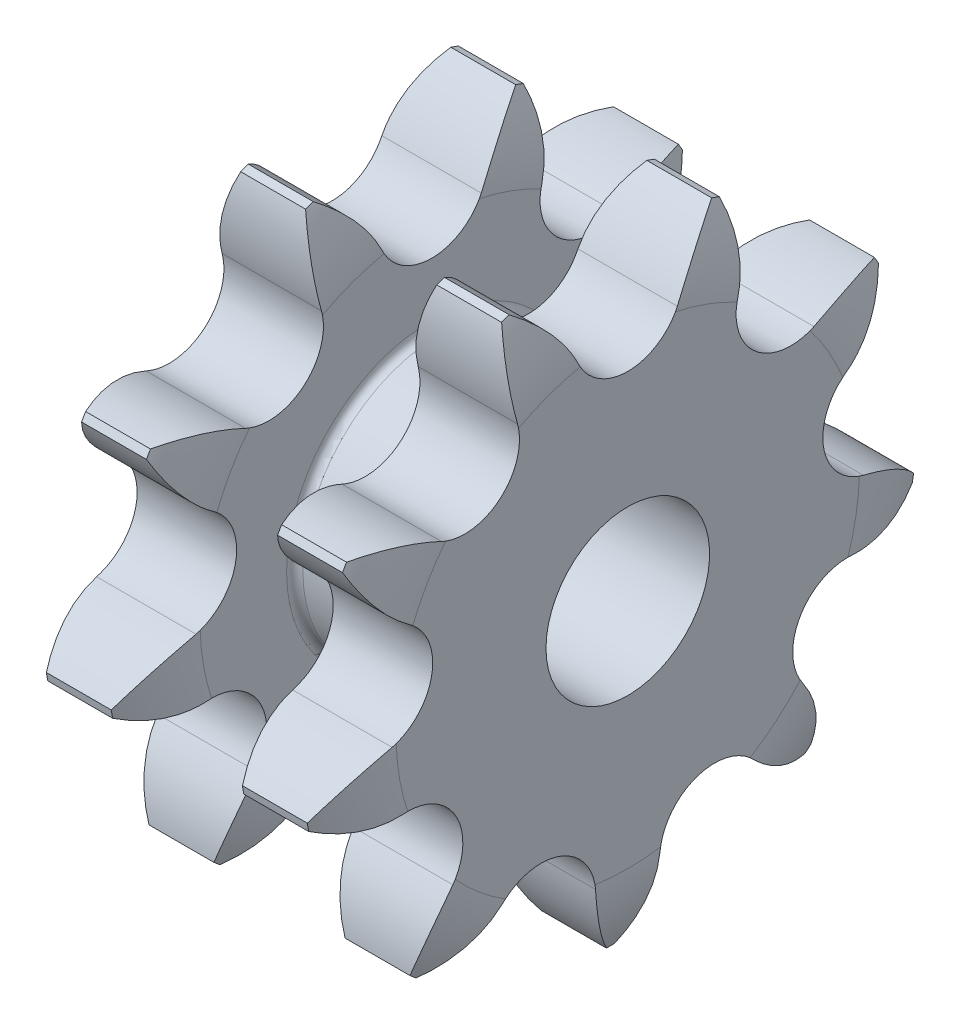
SolidWorks part; units mm, degrees
ref_plane "Plane1" through (0, 0, 0) normal (0, 0, 1) x (1, 0, 0)
ref_plane "Plane2" through (0, 0, 0) normal (0, 1, 0) x (1, 0, 0)
ref_plane "Plane3" through (0, 0, 0) normal (1, 0, 0) x (0, 0, -1)
sketch "Clipboard" plane through (0, 0, 0) normal (0, 1, 0) x (1, 0, 0)
  line L0 (0, 0) -> (12.5436, -1.9867)
  line L1 (-15, 0) -> (100, 0) construction
  line L2 (0, 0) -> (-0.8416, 0.9512)
  line L3 (0, 0) -> (-11.863, 4.5341)
  line L4 (0, 0) -> (3.0618, 0.4849)
  line L5 (0, 0) -> (-2.8109, -1.0484)
  line L6 (0, 0) -> (-17.9719, -12.1257)
  line L7 (-0.8416, 0.9512) -> (22.6002, 5.5078)
  line L8 (-76.2, 38.1) -> (-75.2, 38.1)
  line L9 (-73.4321, 41.7084) -> (-72.837, 41.7846)
  line L10 (-73.4741, 12.9512) -> (-59.0941, 12.9512)
  circle A0 centre (0, 0) radius 3.975
  circle A1 centre (0, 0) radius 10.0465
  circle A2 centre (0, 0) radius 25
sketch "BasProSke" plane through (0, 0, 0) normal (0, 1, 0) x (1, 0, 0)
  line L0 (-10, 0) -> (60, 0) construction
  line L1 (0, 0) -> (0, 16.9929)
  line L2 (0, 0) -> (21.68, 0)
  line L3 (21.68, 0) -> (21.68, 16.9929)
  line L4 (20.41, 22.5287) -> (1.27, 22.5287)
  arc A0 (0, 16.9929) -> (1.27, 22.5287) centre (12.7, 16.9929) cw
  arc A1 (21.68, 16.9929) -> (20.41, 22.5287) centre (8.98, 16.9929) ccw
revolve "Base-Revolve" add sketch "BasProSke" angle 360 about L0
sketch "GrvSke" plane through (0, 0, 0) normal (0, 1, 0) x (1, 0, 0)
  line L0 (7.3, 16.9929) -> (7.3, 10.6465)
  line L1 (7.9, 10.0465) -> (13.78, 10.0465)
  line L2 (14.38, 10.6465) -> (14.38, 16.9929)
  line L3 (6.03, 22.5287) -> (15.65, 22.5287)
  line L4 (10.84, 0) -> (10.84, 52.07) construction
  line L5 (-10, 0) -> (60, 0) construction
  line L6 (0, 0) -> (35.56, 0) construction
  arc A0 (14.38, 16.9929) -> (15.65, 22.5287) centre (27.08, 16.9929) cw
  arc A1 (7.3, 16.9929) -> (6.03, 22.5287) centre (-5.4, 16.9929) ccw
  arc A2 (7.3, 10.6465) -> (7.9, 10.0465) centre (7.9, 10.6465) ccw
  arc A3 (13.78, 10.0465) -> (14.38, 10.6465) centre (13.78, 10.6465) ccw
revolve "Groove" cut sketch "GrvSke" angle 360 about L6
sketch "TooCutSke" plane through (0, 0, 0) normal (1, 0, 0) x (0, 0, -1)
  line L0 (0, 18.6059) -> (3.6386, 16.9092) construction
  line L1 (0, 0) -> (0, 107) construction
  line L2 (0, 18.6059) -> (-10, 18.6059) construction
  line L3 (0, 18.6059) -> (-3.6386, 16.9092) construction
  arc A0 (3.6386, 16.9092) -> (7.9748, 21.6037) centre (13.1494, 12.4742) cw
  arc A1 (3.6386, 16.9092) -> (-3.6386, 16.9092) centre (0, 18.6059) cw
  arc A2 (-3.6386, 16.9092) -> (-7.9748, 21.6037) centre (-13.1494, 12.4742) ccw
  arc A3 (7.9748, 21.6037) -> (-7.9748, 21.6037) centre (0, 0) ccw
extrude "ToothCut" cut sketch "TooCutSke" along normal through all
pattern_circular "TeethCuts" count 9 every 40 about axis through (-10, 0, 0) along (1, 0, 0) of "ToothCut"
sketch "HubNeaOneSke" plane through (0, 0, 0) normal (-1, 0, 0) x (0, 0, 1)
  circle A0 centre (0, 0) radius 10.0465
extrude "HubNearOne" [suppressed] add sketch "HubNeaOneSke" along normal blind 2.2005
fillet "HubNearOneFillet" [suppressed] radius 0.6
sketch "HubNeaBotSke" plane through (0, 0, 0) normal (-1, 0, 0) x (0, 0, 1)
  circle A0 centre (0, 0) radius 10.0465
extrude "HubNearBoth" [suppressed] add sketch "HubNeaBotSke" along normal blind 1.1003
fillet "HubNearBothFillet" [suppressed] radius 0.6
ref_plane "FarPln" through (21.68, 0, 0) normal (1, 0, 0) x (0, 0, -1)
sketch "HubFarSke" plane through (21.68, 0, 0) normal (1, 0, 0) x (0, 0, -1)
  circle A0 centre (0, 0) radius 10.0465
extrude "HubFar" [suppressed] add sketch "HubFarSke" along normal blind 1.1003
fillet "HubFarFillet" [suppressed] radius 0.6
sketch "BorSke" plane through (0, 0, 0) normal (1, 0, 0) x (0, 0, -1)
  circle A0 centre (0, 0) radius 6
extrude "Bore" cut sketch "BorSke" along normal mid plane 47.761
sketch "KeySke" plane through (0, 0, 0) normal (1, 0, 0) x (0, 0, -1)
  line L0 (-1, 0) -> (-1, 7)
  line L1 (-1, 7) -> (1, 7)
  line L2 (1, 7) -> (1, 0)
  line L3 (0, 0) -> (0, 34) construction
  line L4 (-1, 0) -> (1, 0)
extrude "Keyway" [suppressed] cut sketch "KeySke" along normal mid plane 47.761
pattern_circular "Keyway2" [suppressed] count 2 every 90 about axis through (-10, 0, 0) along (1, 0, 0)
equation "' \"Pitch@Clipboard\" = 12.7"
equation "' \"Num_strands@Clipboard\" = 2"
equation "' \"Num_teeth@Clipboard\" = 9"
equation "' \"Hub_dia@Clipboard\" = 50"
equation "' \"Overall_len@Clipboard\" = 3"
equation "' \"Diameter@BorSke\" = 12"
equation "' \"T_dim@Clipboard\" = 1"
equation "' \"Width@KeySke\" = 2"
equation "' \"Dr@Clipboard\" = 7.95"
equation "' \"Face_width@Clipboard\" = 7.3"
equation "' \"Side_radius@Clipboard\" = 12.7"
equation "' \"Side_relief@Clipboard\" = 1.27"
equation "' \"Transv_pitch@Clipboard\" = 14.38"
equation "' \"Show_teeth@Clipboard\" = 9"
equation "' \"Fillet_rad@Clipboard\" = 0.6"
equation "' \"Plate_wid@Clipboard\" = 12"
equation "\"Num_teeth@Clipboard\" = int( \"Num_teeth@Clipboard\" )"
equation "\"Num_teeth@Clipboard\" = ((sgn( \"Num_teeth@Clipboard\" - 5.0)+1)*( \"Num_teeth@Clipboard\" - 5.0))/2 +5.0"
equation "\"Num_teeth@Clipboard\" = ((sgn( \"Num_teeth@Clipboard\" - 200.0)-1)*( \"Num_teeth@Clipboard\" - 200.0))/-2 +200.0"
equation "\"MHD@Clipboard\" = \"Pitch@Clipboard\" * (1.0 / tan(3.14159265 / \"Num_teeth@Clipboard\" )) - 1.05 * \"Plate_wid@Clipboard\" - 2.0 * \"Fillet_rad@Clipboard\" - 1.0"
equation "\"Thickness@Clipboard\"  = \"Face_width@Clipboard\" + (\"Num_strands@Clipboard\" - 1) * \"Transv_pitch@Clipboard\""
equation "\"OAL@Clipboard\" = \"Thickness@Clipboard\" + 2 * \"Fillet_rad@Clipboard\" + 1"
equation "\"MHD@Clipboard\" = ((sgn( \"MHD@Clipboard\" - \"Hub_dia@Clipboard\" )-1)*( \"MHD@Clipboard\" - \"Hub_dia@Clipboard\" ))/-2+ \"Hub_dia@Clipboard\""
equation "\"OAL@Clipboard\" = ((sgn( \"OAL@Clipboard\" - \"Overall_len@Clipboard\" )+1)*( \"OAL@Clipboard\" - \"Overall_len@Clipboard\" ))/2 + \"Overall_len@Clipboard\" + 0.0005"
equation "\"Num_teeth@TeethCuts\" = int( \"Show_teeth@Clipboard\" ) + 1"
equation "\"Num_teeth@TeethCuts\" = ((sgn( \"Num_teeth@TeethCuts\" - \"Num_teeth@Clipboard\" )-1)*( \"Num_teeth@TeethCuts\" - \"Num_teeth@Clipboard\" ))/-2+ \"Num_teeth@Clipboard\""
equation "\"Num_teeth@TeethCuts\" = ((sgn( \"Num_teeth@TeethCuts\" - 2.0)+1)*( \"Num_teeth@TeethCuts\" - 2.0))/2 +2.0"
equation "\"Angle@TeethCuts\" = 360.0 / \"Num_teeth@Clipboard\""
equation "\"Seat_radius@TooCutSke\" = ( \"Pitch@Clipboard\" / 2.0) / sin(3.14159265 / \"Num_teeth@Clipboard\" ) - \"Dr@Clipboard\" / 2.0 + \"Dr@Clipboard\" * 0.505"
equation "\"R1@TooCutSke\"  = \"Dr@Clipboard\" * 0.505"
equation "\"X@TooCutSke\" = 140.0 - (90.0 / \"Num_teeth@Clipboard\")"
equation "\"R2@TooCutSke\" = 0.12 * \"Dr@Clipboard\" * ( \"Num_teeth@Clipboard\" + 2.0)"
equation "\"Overcut@TooCutSke\" = 0.5 + 0.625 * \"Pitch@Clipboard\" - 0.5 * \"Dr@Clipboard\"  +  \"Pitch@Clipboard\" / 2.0 / sin(3.14159265 / \"Num_teeth@Clipboard\" )"
equation "\"Diameter@BasProSke\" = 2.0 * ( 0.625 * \"Pitch@Clipboard\" - 0.5 * \"Dr@Clipboard\"  +  \"Pitch@Clipboard\" / 2.0 / sin(3.14159265 / \"Num_teeth@Clipboard\" ))"
equation "\"Thickness@BasProSke\"  = \"Thickness@Clipboard\""
equation "\"G1@BasProSke\" =  \"Side_relief@Clipboard\""
equation "\"G2@BasProSke\" =  \"Side_relief@Clipboard\""
equation "\"D1@BasProSke\" =  \"Side_radius@Clipboard\""
equation "\"Diameter@GrvSke\" = \"Diameter@BasProSke\""
equation "\"G1@GrvSke\" = \"Side_relief@Clipboard\""
equation "\"D1@GrvSke\" = \"Side_radius@Clipboard\""
equation "\"Grv_diam@GrvSke\" =  \"Pitch@Clipboard\" * (1.0 / tan(3.14159265 / \"Num_teeth@Clipboard\" ))- 1.05 * \"Plate_wid@Clipboard\" - 2.0 * \"Fillet_rad@Clipboard\" - 1.0"
equation "\"Grv_width@GrvSke\" =  \"Transv_pitch@Clipboard\" - \"Face_width@Clipboard\""
equation "\"Offset@GrvSke\" = \"Grv_width@GrvSke\" / 2.0 + \"Face_width@Clipboard\""
equation "\"Fillet_rad@GrvSke\" = \"Fillet_rad@Clipboard\""
equation "\"Diameter@HubNeaOneSke\" = \"MHD@Clipboard\""
equation "\"Length@HubNearOne\" = \"OAL@Clipboard\" - \"Thickness@BasProSke\""
equation "\"Diameter@HubNeaBotSke\" = \"MHD@Clipboard\""
equation "\"Length@HubNearBoth\" = ( \"OAL@Clipboard\" - \"Thickness@BasProSke\" ) / 2.0"
equation "\"D1@HubNearOneFillet\" = \"Fillet_rad@Clipboard\""
equation "\"D1@HubNearBothFillet\" = \"Fillet_rad@Clipboard\""
equation "\"Thickness@FarPln\" = \"Thickness@BasProSke\""
equation "\"Diameter@HubFarSke\" = \"MHD@Clipboard\""
equation "\"Length@HubFar\" = ( \"OAL@Clipboard\" - \"Thickness@BasProSke\" ) / 2.0"
equation "\"D1@HubFarFillet\" = \"Fillet_rad@Clipboard\""
equation "\"D1@Bore\" = \"OAL@Clipboard\" * 2.0"
equation "\"D1@Keyway\" = \"OAL@Clipboard\" * 2.0"
equation "\"Offset@KeySke\" = \"T_dim@Clipboard\" + \"Diameter@BorSke\" / 2.0"
